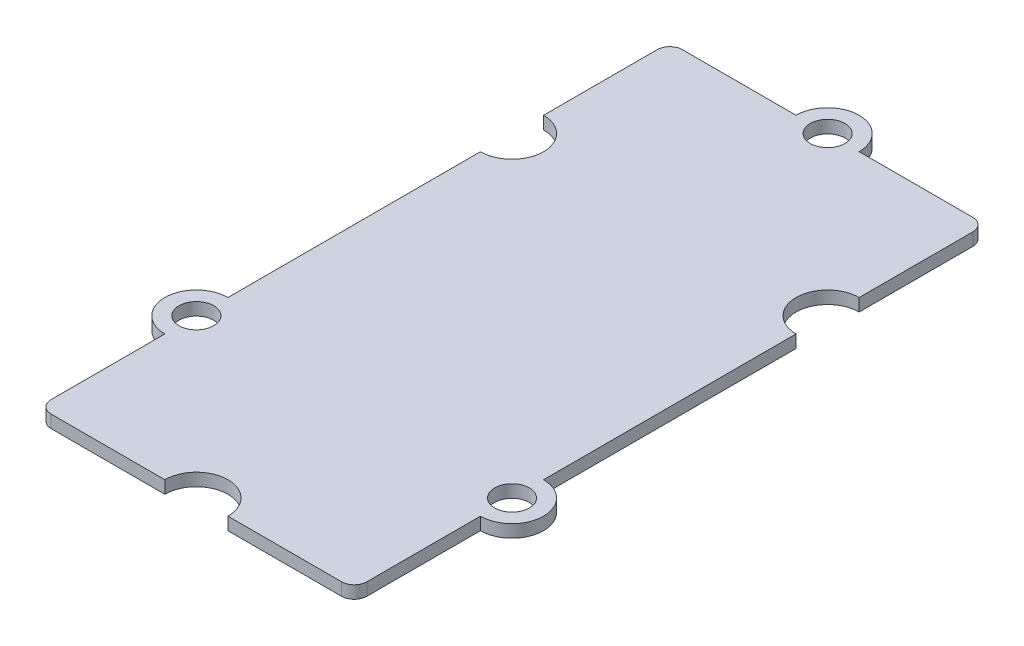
SolidWorks part; units mm, degrees
ref_plane "Front Plane" through (0, 0, 0) normal (0, 0, 1) x (1, 0, 0)
ref_plane "Top Plane" through (0, 0, 0) normal (0, 1, 0) x (1, 0, 0)
ref_plane "Right Plane" through (0, 0, 0) normal (1, 0, 0) x (0, 0, -1)
sketch "Sketch1" plane through (0, 0, 0) normal (0, 1, 0) x (1, 0, 0)
  line L0 (10, 0) -> (10, 40) construction
  line L1 (0.8, 0) -> (8, 0)
  line L2 (0, 0.8) -> (0, 8)
  line L3 (0.8, 40) -> (8, 40)
  line L4 (20, 0.8) -> (20, 8)
  line L5 (12, 40) -> (19.2, 40)
  line L6 (0, 32) -> (0, 39.2)
  line L7 (20, 32) -> (20, 39.2)
  line L8 (0, 12) -> (0, 28)
  line L9 (20, 12) -> (20, 28)
  line L10 (12, 0) -> (19.2, 0)
  arc A0 (0.8, 0) -> (0, 0.8) centre (0.8, 0.8) cw
  arc A1 (19.2, 0) -> (20, 0.8) centre (19.2, 0.8) ccw
  arc A2 (19.2, 40) -> (20, 39.2) centre (19.2, 39.2) cw
  arc A3 (0, 39.2) -> (0.8, 40) centre (0.8, 39.2) cw
  arc A4 (12, 40) -> (8, 40) centre (10, 40) ccw
  circle A5 centre (10, 40) radius 1.1
  arc A6 (0, 28) -> (0, 32) centre (0, 30) ccw
  arc A7 (20, 32) -> (20, 28) centre (20, 30) ccw
  arc A8 (0, 12) -> (0, 8) centre (0, 10) ccw
  arc A9 (20, 8) -> (20, 12) centre (20, 10) ccw
  arc A10 (12, 0) -> (8, 0) centre (10, 0) ccw
  circle A11 centre (0, 10) radius 1.1
  circle A12 centre (20, 10) radius 1.1
  point P7 (0, 0)
  point P10 (20, 0)
  point P13 (20, 40)
  dimension "D3" = 0.8
  dimension "D4" = 2
  dimension "D5" = 2.2
  dimension "D1" = 20
  dimension "D2" = 40
  dimension "D6" = 10
  dimension "D7" = 30
  dimension "D8" = 30
extrude "Board" add sketch "Sketch1" along normal blind 0.8
